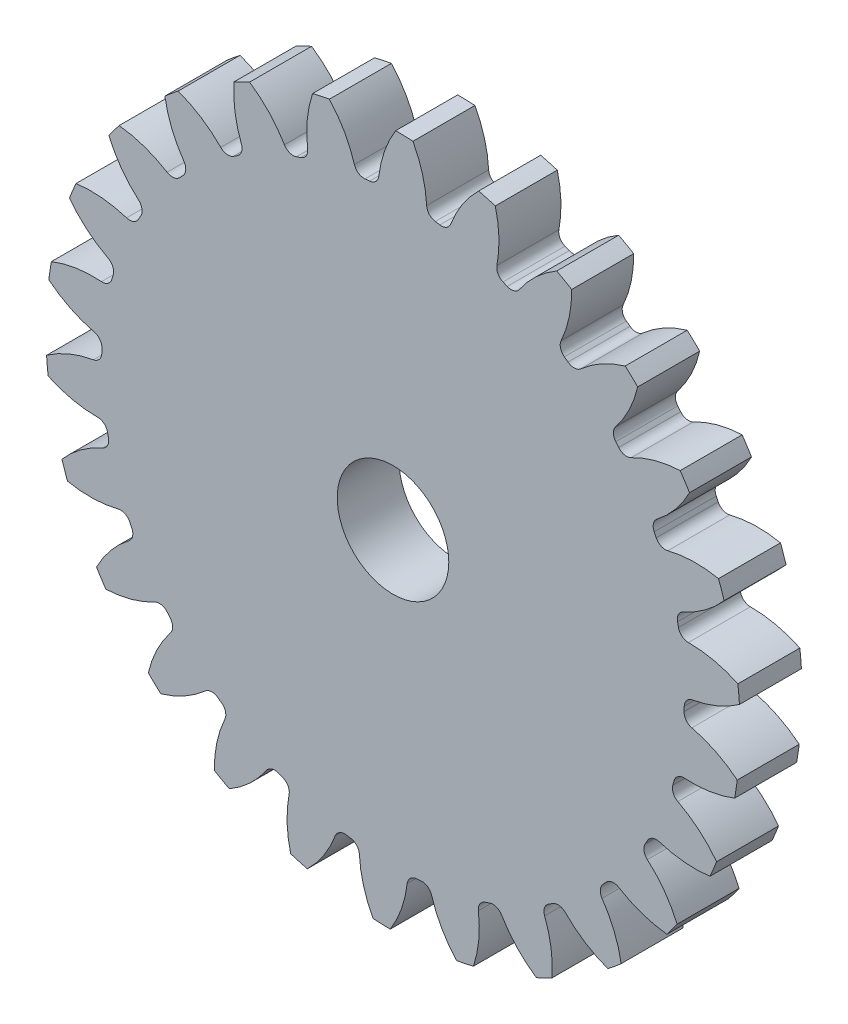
SolidWorks part; units mm, degrees
ref_plane "Front" through (0, 0, 0) normal (0, 0, 1) x (1, 0, 0)
ref_plane "Top" through (0, 0, 0) normal (0, 1, 0) x (1, 0, 0)
ref_plane "Right" through (0, 0, 0) normal (1, 0, 0) x (0, 0, -1)
sketch "Sketch3" plane through (0, 0, 0) normal (0, 0, 1) x (1, 0, 0)
  circle A0 centre (0, 0) radius 711.2
  dimension "od" = 1422.4
extrude "gearBody" add sketch "Sketch3" along normal blind 127
sketch "Sketch2" plane through (0, 0, 0) normal (0, 0, 1) x (1, 0, 0)
  line L0 (0, 0) -> (573.3347, 237.483) construction
  line L1 (706.6864, -92.3214) -> (0, 0) construction
  line L2 (0, 0) -> (36.3143, 0) construction
  line L3 (660.1504, 18.1557) -> (657.5648, -61.129) construction
  line L5 (658.8576, -21.4866) -> (0, 0) construction
  line L7 (0, 0) -> (620.573, 0) construction
  arc A0 (620.5403, 6.3704) -> (618.8067, -46.7879) centre (0, 0) ccw construction
  arc A1 (709.7711, 45.0602) -> (705.3271, -91.2093) centre (0, 0) ccw construction
  arc A2 (660.1504, 18.1557) -> (657.5648, -61.129) centre (0, 0) ccw construction
  arc A3 (596.4111, -24.1547) -> (596.7176, -14.7556) centre (0, 0) ccw
  arc A4 (706.6864, -92.3214) -> (612.2001, -45.0853) centre (556.6434, -274.3338) ccw
  arc A5 (706.6864, -92.3214) -> (711.2, 46.0814) centre (0, 0) ccw
  arc A6 (711.2, 46.0814) -> (613.8368, 5.1019) centre (573.3347, 237.483) cw
  arc A7 (596.7176, -14.7556) -> (613.8368, 5.1019) centre (617.3869, -15.2667) cw
  arc A8 (612.2001, -45.0853) -> (596.4111, -24.1547) centre (617.0697, -24.9913) cw
  point P6 (711.2, 46.0814)
  point P22 (706.6864, -92.3214)
  dimension "baseDia" = 1241.146
  dimension "od" = 1422.4
  dimension "pd" = 1320.8
  dimension "rd" = 1193.8
  dimension "rFillet" = 20.6756
  dimension "pointX" = 711.2
  dimension "pointY" = 46.0814
  dimension "CTT" = 79.2847
  dimension "flankCenterAngle" = 22.5
extrude "toothCut" cut sketch "Sketch2" along normal through all
pattern_circular "CirPattern1" count 26 over 360 about axis through (0, 0, 0) along (0, 0, 1) of "toothCut"
sketch "hub1Dia" plane through (0, 0, 0) normal (0, 0, -1) x (-1, 0, 0)
  circle A0 centre (0, 0) radius 12.7
  dimension "hub1Dia" = 25.4
sketch "hub2Dia" plane through (0, 0, 127) normal (0, 0, 1) x (1, 0, 0)
  circle A0 centre (0, 0) radius 12.7
  dimension "hub2dia" = 25.4
sketch "boreDia" plane through (0, 0, 0) normal (0, 0, 1) x (1, 0, 0)
  circle A0 centre (0, 0) radius 114.3
  dimension "boreDia" = 228.6
extrude "bore" cut sketch "boreDia" against normal mid plane 25400
